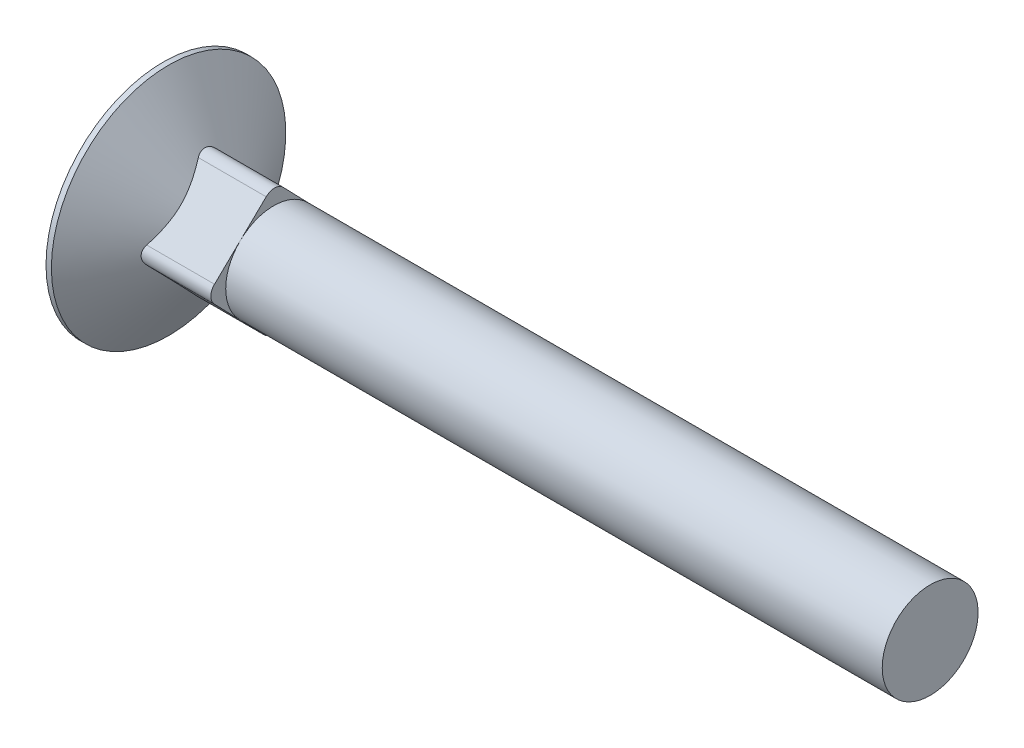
SolidWorks part; units mm, degrees
revolve "Base-Revolve" add sketch "BodySke"
sketch "BodySke" plane through (0, 0, 0) normal (0, 0, 1) x (1, 0, 0)
  line L0 (0, 0) -> (0, 11.6459)
  line L1 (0, 11.6459) -> (0.5337, 11.6459)
  line L2 (5.0038, 4.7625) -> (76.2, 4.7625)
  line L3 (76.2, 4.7625) -> (76.2, 0)
  line L4 (76.2, 0) -> (0, 0)
  line L5 (-6.35, 0) -> (82.55, 0) construction
  line L6 (5.0038, -4.7625) -> (76.2, -4.7625) construction
  line L7 (0.5337, -11.6459) -> (5.0038, -4.7625) construction
  line L8 (0.5337, 11.6459) -> (5.0038, 4.7625)
  line L9 (0, -11.6459) -> (0.5337, -11.6459) construction
  line L10 (74.6125, 9.525) -> (74.6125, 3.175) construction
  line L11 (38.1, 9.525) -> (38.1, 3.175) construction
  dimension "Diameter" = 9.525
  dimension "Length" = 76.2
  dimension "Head_ht" = 5.0038
  dimension "Head_dia" = 23.2918
  dimension "Head_ang" = 114
  dimension "D6" = 0.5337
  dimension "Advance" = 1.5875
  dimension "Thread_nom" = 38.1
revolve "Cut-Revolve1" cut sketch "Sketch3" angle 360 about L5
sketch "Sketch3" plane through (0, 0, 0) normal (0, 0, 1) x (1, 0, 0)
  line L0 (-0.3337, 24.3459) -> (10.9728, 4.7625)
  line L1 (10.9728, 4.7625) -> (11.2268, 4.7625)
  line L2 (11.2268, 4.7625) -> (11.2268, 24.3459)
  line L3 (11.2268, 24.3459) -> (-0.3337, 24.3459)
  line L4 (0, 0) -> (22.225, 0) construction
  line L8 (0.5337, 11.6459) -> (0, 11.6459) construction
  dimension "D1" = 360
ref_plane "Plane1" through (0, 0, 0) normal (0, 0, 1) x (1, 0, 0)
ref_plane "Plane2" through (0, 0, 0) normal (0, 1, 0) x (1, 0, 0)
ref_plane "Plane3" through (0, 0, 0) normal (1, 0, 0) x (0, 0, -1)
sketch "Sketch2" plane through (0, 0, 0) normal (1, 0, 0) x (0, 0.6947, -0.7193)
  line L1 (3.5687, -4.7625) -> (-3.5687, -4.7625)
  line L2 (4.7625, -3.5687) -> (4.7625, 3.5687)
  line L3 (3.5687, 4.7625) -> (-3.5687, 4.7625)
  line L4 (-4.7625, -3.5687) -> (-4.7625, 3.5687)
  arc A0 (3.5687, 4.7625) -> (4.7625, 3.5687) centre (3.5687, 3.5687) cw
  arc A1 (3.5687, -4.7625) -> (4.7625, -3.5687) centre (3.5687, -3.5687) ccw
  arc A2 (-4.7625, -3.5687) -> (-3.5687, -4.7625) centre (-3.5687, -3.5687) ccw
  arc A3 (-3.5687, 4.7625) -> (-4.7625, 3.5687) centre (-3.5687, 3.5687) ccw
extrude "Neck" add sketch "Sketch2" along normal blind 10.9728
sketch "ThdSchSke" plane through (0, 0, 0) normal (0, 0, 1) x (1, 0, 0)
  line L0 (38.1, -3.8163) -> (37.4375, -4.7625)
  line L1 (38.1, -3.8163) -> (38.7625, -4.7625)
  line L2 (38.7625, -4.7625) -> (38.7625, -5.9531)
  line L3 (-3.175, 0) -> (5.1513, 0) construction
  line L5 (38.7625, -5.9531) -> (37.4375, -5.9531)
  line L6 (37.4375, -5.9531) -> (37.4375, -4.7625)
  line L7 (0, 11.6459) -> (0, -11.6459) construction
revolve "ThreadSchematic" [suppressed] cut sketch "ThdSchSke" angle 360 about L3
pattern_linear "ThdSchPat" [suppressed]
equation "\"D1@Sketch2\" = \"Neck_width@Sketch2\"/2"
equation "\"D2@Sketch2\" = \"Neck_width@Sketch2\""
equation "\"D3@Sketch2\" = \"D2@Sketch2\"/2"
equation "\"D2@Sketch3\" = \"Neck_ht@Neck\""
equation "\"D5@Sketch3\" = \"Diameter@BodySke\"/2"
equation "\"Thread_length@ThreadCosmetic\" = ((sgn( (\"Length@BodySke\" - \"Advance@BodySke\" * 1.5 - \"Neck_ht@Neck\" ) - \"Thread_nom@BodySke\" )-1)*( (\"Length@BodySke\" - \"Advance@BodySke\" * 1.5 -  \"Neck_ht@Neck\" ) - \""
equation "\"Thread_minor@ThdSchSke\" = \"Thread_minor@ThreadCosmetic\""
equation "\"Diameter@ThdSchSke\" = \"Diameter@BodySke\""
equation "\"Overcut@ThdSchSke\" = \"Diameter@BodySke\" * 1.25"
equation "\"Start@ThdSchSke\" = 0.000001 + \"Length@BodySke\" - \"Thread_length@ThreadCosmetic\"  '---Countersunk---"
equation "\"Num_threads@ThdSchPat\" = int( \"Thread_length@ThreadCosmetic\" / \"Advance@BodySke\" + 0.999 )  + 1"
equation "\"Advance@ThdSchPat\" = \"Thread_length@ThreadCosmetic\" /  (\"Num_threads@ThdSchPat\" - 1) 'relax it"
